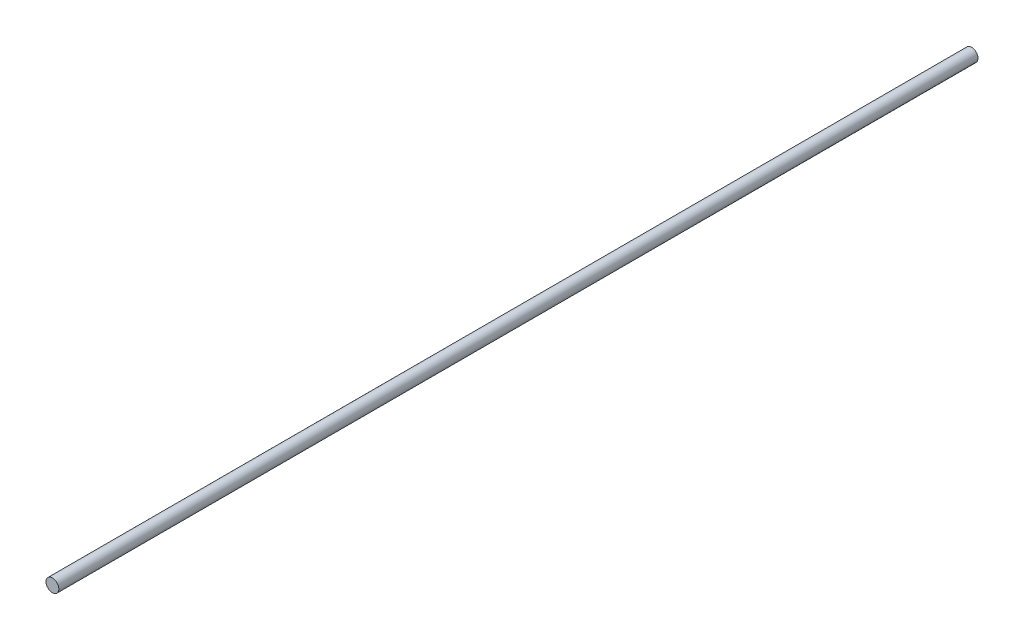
SolidWorks part; units mm, degrees
ref_plane "Front Plane" through (0, 0, 0) normal (0, 0, 1) x (1, 0, 0)
ref_plane "Top Plane" through (0, 0, 0) normal (0, 1, 0) x (1, 0, 0)
ref_plane "Right Plane" through (0, 0, 0) normal (1, 0, 0) x (0, 0, -1)
sketch "Sketch1" plane through (0, 0, 0) normal (0, 0, 1) x (1, 0, 0)
  circle A0 centre (0, 0) radius 30
  dimension "D1" = 60
extrude "Boss-Extrude1" add sketch "Sketch1" against normal blind 4300
